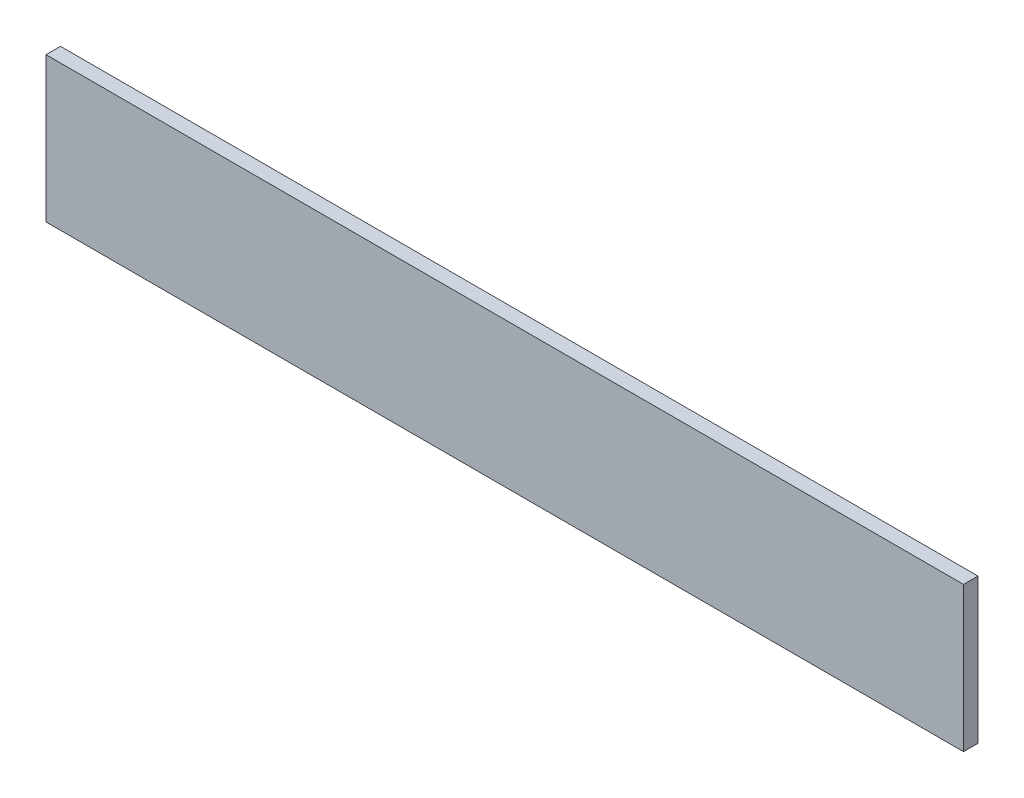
SolidWorks part; units mm, degrees
ref_plane "前视基准面" through (0, 0, 0) normal (0, 0, 1) x (1, 0, 0)
ref_plane "上视基准面" through (0, 0, 0) normal (0, 1, 0) x (1, 0, 0)
ref_plane "右视基准面" through (0, 0, 0) normal (1, 0, 0) x (0, 0, -1)
sketch "草图1" plane through (0, 0, 0) normal (0, 0, 1) x (1, 0, 0)
  line L1 (0, 0) -> (380, 0)
  line L2 (0, 0) -> (0, 60)
  line L3 (0, 60) -> (380, 60)
  line L4 (380, 0) -> (380, 60)
  dimension "D1" = 60
  dimension "D2" = 380
extrude "拉伸1" add sketch "草图1" along normal blind 6
